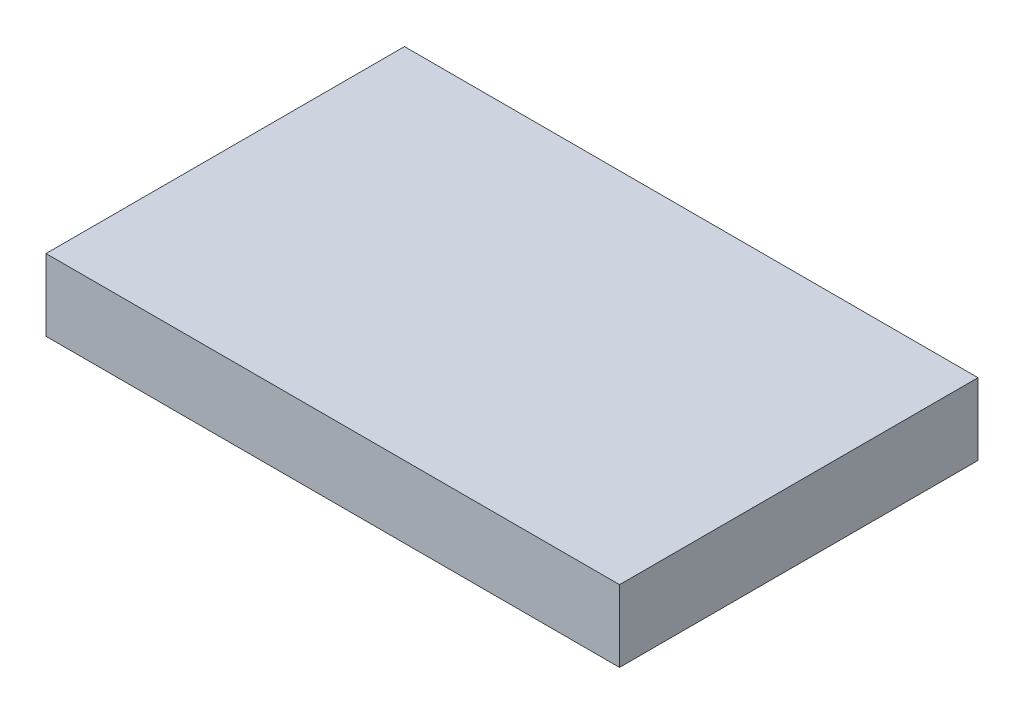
SolidWorks part; units mm, degrees
ref_plane "Front" through (0, 0, 0) normal (0, 0, 1) x (1, 0, 0)
ref_plane "Top" through (0, 0, 0) normal (0, 1, 0) x (1, 0, 0)
ref_plane "Right" through (0, 0, 0) normal (1, 0, 0) x (0, 0, -1)
sketch "Sketch2" plane through (0, 0, 0) normal (0, 1, 0) x (1, 0, 0)
  line L0 (60, -37.5) -> (-60, 37.5) construction
  line L1 (-60, 37.5) -> (60, 37.5)
  line L2 (-60, 37.5) -> (-60, -37.5)
  line L3 (-60, -37.5) -> (60, -37.5)
  line L4 (60, 37.5) -> (60, -37.5)
  dimension "D1" = 75
  dimension "D2" = 120
extrude "Extrude1" add sketch "Sketch2" along normal blind 15
